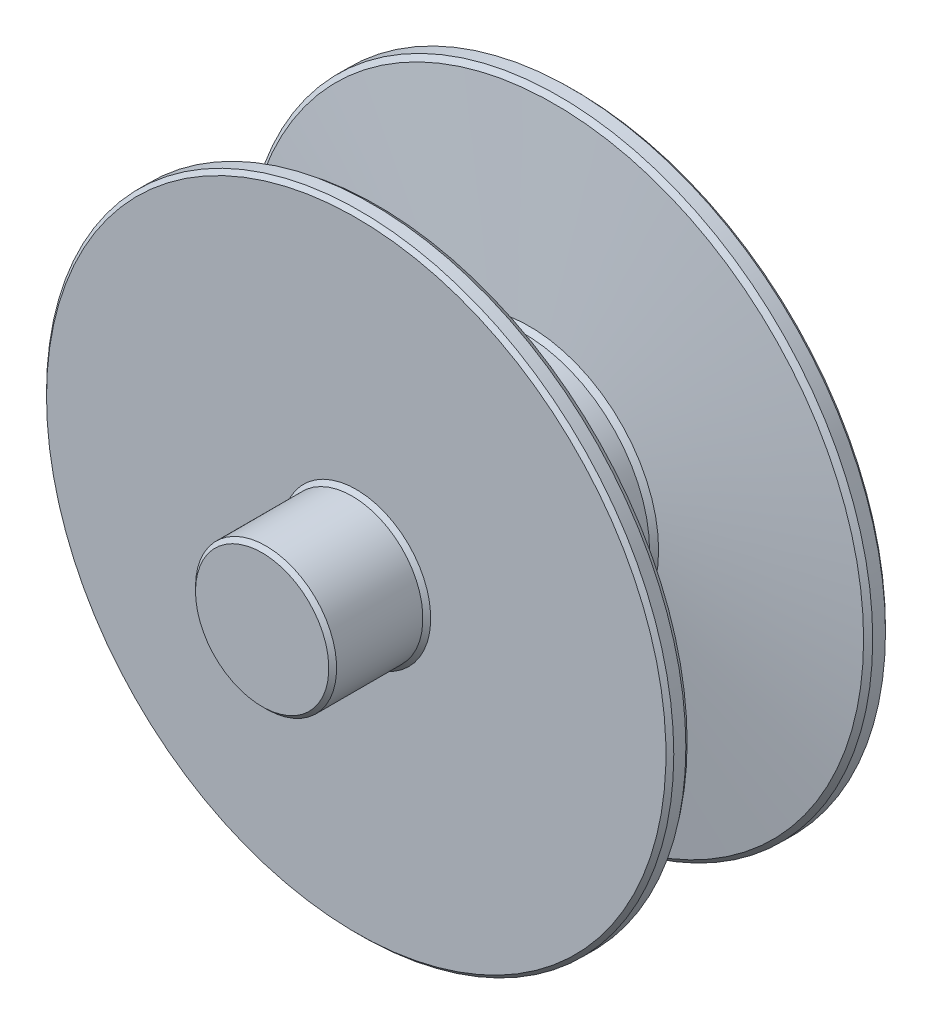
SolidWorks part; units mm, degrees
ref_plane "Спереди" through (0, 0, 0) normal (0, 0, 1) x (1, 0, 0)
ref_plane "Сверху" through (0, 0, 0) normal (0, 1, 0) x (1, 0, 0)
ref_plane "Справа" through (0, 0, 0) normal (1, 0, 0) x (0, 0, -1)
sketch "Эскиз1" plane through (0, 0, 0) normal (1, 0, 0) x (0, 0, -1)
  line L0 (0, 0) -> (26, 0)
  line L1 (26, 0) -> (26, 4.5)
  line L2 (26, 4.5) -> (20, 4.5)
  line L3 (20, 4.5) -> (20, 20)
  line L4 (20, 20) -> (18.6865, 20)
  line L5 (7.3135, 20) -> (9, 8)
  line L6 (17, 8) -> (9, 8)
  line L7 (13, 8) -> (13, 20) construction
  line L8 (7.3135, 20) -> (6, 20)
  line L9 (6, 20) -> (6, 4.5)
  line L10 (6, 4.5) -> (0, 4.5)
  line L11 (0, 4.5) -> (0, 0)
  line L12 (18.6865, 20) -> (17, 8)
  dimension "D1" = 4.5
  dimension "D2" = 20
  dimension "D3" = 8
  dimension "D4" = 8
  dimension "D5" = 14
  dimension "D6" = 26
  dimension "D7" = 16
revolve "Повернуть1" add sketch "Эскиз1" angle 360 about L0
chamfer "Фаска1" distance 0.25 angle 45 10 edges at (8, 0, -17) (8, 0, -9) (20, 0, -7.3135) (20, 0, -6) (20, 0, -20) (20, 0, -18.6865) (4.5, 0, -26) (4.5, 0, -20) (4.5, 0, -6) (4.5, 0, 0)
